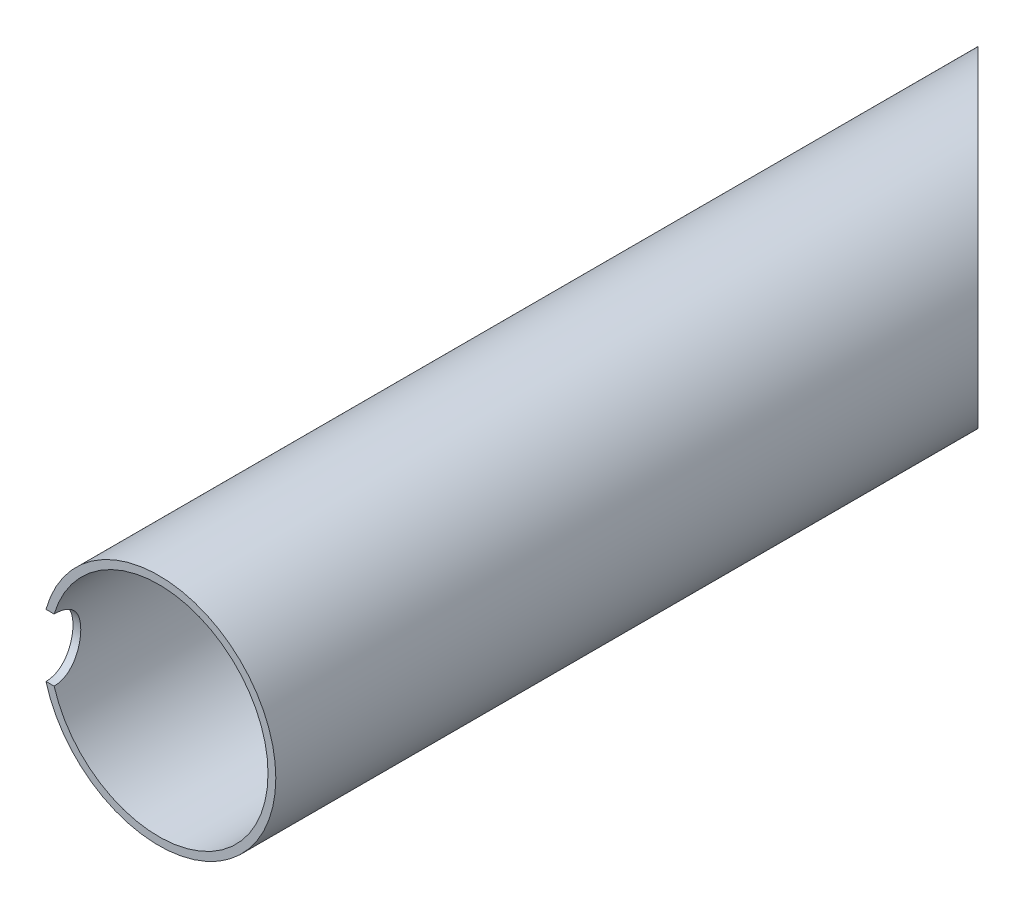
SolidWorks part; units mm, degrees
ref_plane "Ön Düzlem" through (0, 0, 0) normal (0, 0, 1) x (1, 0, 0)
ref_plane "Üst Düzlem" through (0, 0, 0) normal (0, 1, 0) x (1, 0, 0)
ref_plane "Sağ Düzlem" through (0, 0, 0) normal (1, 0, 0) x (0, 0, -1)
sketch "Çizim1" plane through (0, 0, 0) normal (0, 0, 1) x (1, 0, 0)
  circle A0 centre (0, 0) radius 15
  circle A1 centre (0, 0) radius 14
  dimension "D1" = 30
  dimension "D2" = 28
extrude "Yükseklik-Ekstrüzyon1" add sketch "Çizim1" along normal blind 120
sketch "Çizim2" plane through (0, 0, 0) normal (0, 1, 0) x (1, 0, 0)
  line L0 (-23.0571, 8.0571) -> (27.6992, -42.6992) construction
  line L1 (14, 0) -> (-14, 0) construction
  line L2 (-23.0571, 8.0571) -> (28.6664, -43.6664)
  line L3 (28.6664, -43.6664) -> (30.0937, 12.1118)
  line L4 (30.0937, 12.1118) -> (-23.0571, 8.0571)
  dimension "D1" = 45
extrude "Kes-Ekstrüzyon1" cut sketch "Çizim2" against normal mid plane 120
sketch "Çizim3" plane through (-7.5, 0, 7.5) normal (0.7071, 0, -0.7071) x (-0.7071, 0, -0.7071)
  line L0 (-10.6066, 15) -> (-10.6066, -26.0024) construction
  line L1 (19.4967, 0) -> (-55.4698, 0) construction
  ellipse E0 centre (-10.6066, 0) end of major axis (-44.0275, 0) minor radius 20.0665
extrude "Yükseklik-Ekstrüzyon2" add sketch "Çizim3" against normal blind 5
sketch "Çizim4" plane through (0, 0, 120) normal (0, 0, 1) x (1, 0, 0)
  circle A0 centre (0, 0) radius 15
  circle A1 centre (0, 0) radius 35.1843
extrude "Kes-Ekstrüzyon2" cut sketch "Çizim4" against normal blind 155
sketch "Çizim5" plane through (0, 0, 120) normal (0, 0, 1) x (1, 0, 0)
  circle A0 centre (0, 0) radius 1.5 construction
  circle A1 centre (-1.5, 0) radius 1 construction
  circle A2 centre (1.5, 0) radius 1 construction
  circle A3 centre (0, -1.5) radius 1
  circle A4 centre (0, 1.5) radius 1
  dimension "D1" = 3
  dimension "D2" = 2
  dimension "D3" = 2
  dimension "D4" = 2
  dimension "D5" = 2
extrude "Kes-Ekstrüzyon3" cut sketch "Çizim5" against normal blind 155
sketch "Çizim12" plane through (-7.5, 0, 7.5) normal (0.7071, 0, -0.7071) x (-0.7071, 0, -0.7071)
  circle A0 centre (-10.6066, 0) radius 5 construction
  circle A1 centre (-15.6066, 0) radius 1.6
  circle A2 centre (-10.6066, 5) radius 1.6
  circle A3 centre (-5.6066, 0) radius 1.6
  circle A4 centre (-10.6066, -5) radius 1.6
  point P13 (-10.6066, 0)
  dimension "D1" = 10
  dimension "D2" = 3.2
  dimension "D3" = 4
extrude "Kes-Ekstrüzyon4" cut sketch "Çizim12" against normal blind 1.6
sketch "Çizim13" plane through (0, 0, 0) normal (1, 0, 0) x (0, 0, -1)
  line L0 (-120, 15) -> (-120, -15) construction
  line L1 (-120, 4) -> (-120, -4)
  arc A0 (-120, -4) -> (-120, 4) centre (-120, 0) ccw
  dimension "D1" = 8
extrude "Kes-Ekstrüzyon5" cut sketch "Çizim13" against normal blind 40.8
sketch "Çizim14" plane through (-7.5, 0, 7.5) normal (0.7071, 0, -0.7071) x (-0.7071, 0, -0.7071)
  circle A0 centre (-10.6066, 0) radius 10.0643 construction
  text T0 "TP TP TP TP TP TP TP TP TP TP" font "Century Gothic" height in points 16
extrude "Kes-Ekstrüzyon6" cut sketch "Çizim14" against normal blind 0.6
